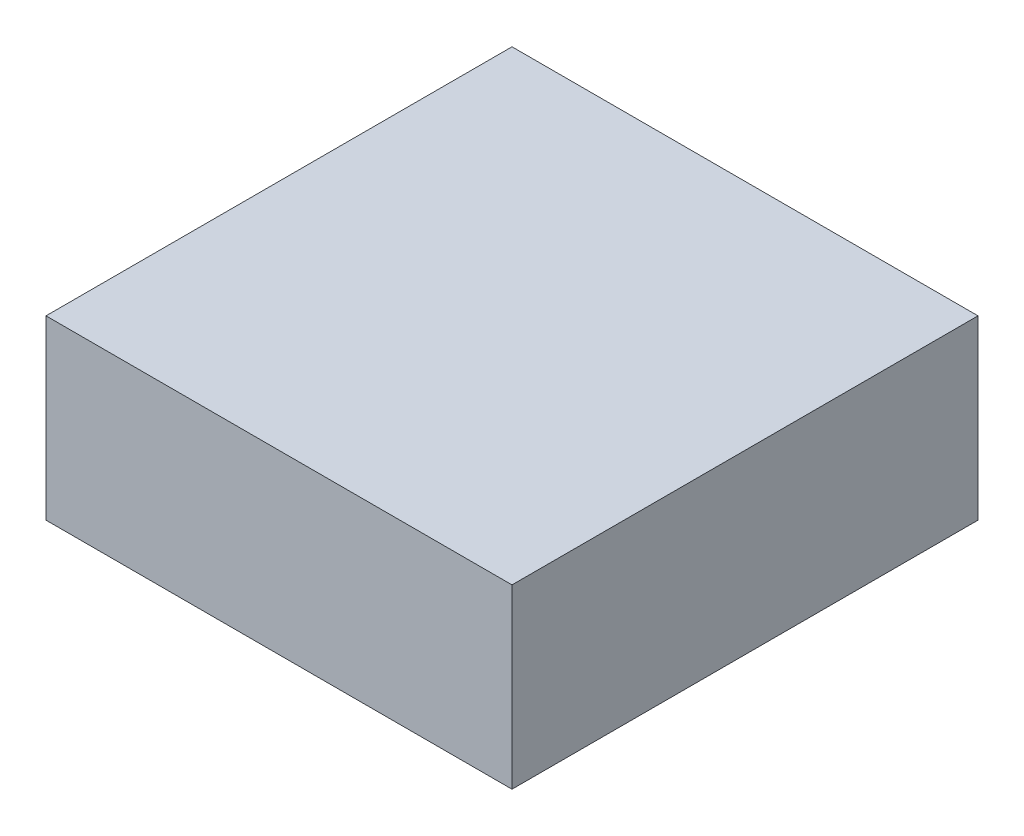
SolidWorks part; units mm, degrees
ref_plane "Front Plane" through (0, 0, 0) normal (0, 0, 1) x (1, 0, 0)
ref_plane "Top Plane" through (0, 0, 0) normal (0, 1, 0) x (1, 0, 0)
ref_plane "Right Plane" through (0, 0, 0) normal (1, 0, 0) x (0, 0, -1)
sketch "Sketch1" plane through (0, 0, 0) normal (0, 1, 0) x (1, 0, 0)
  line L1 (7.9, -7.9) -> (-7.9, -7.9)
  line L2 (7.9, -7.9) -> (7.9, 7.9)
  line L3 (7.9, 7.9) -> (-7.9, 7.9)
  line L4 (-7.9, -7.9) -> (-7.9, 7.9)
  line L5 (7.9, -7.9) -> (-7.9, 7.9) construction
  line L6 (7.9, 7.9) -> (-7.9, -7.9) construction
  point P0 (0, 0)
  dimension "D1" = 15.8
  dimension "D2" = 15.8
extrude "Boss-Extrude1" add sketch "Sketch1" along normal blind 6
